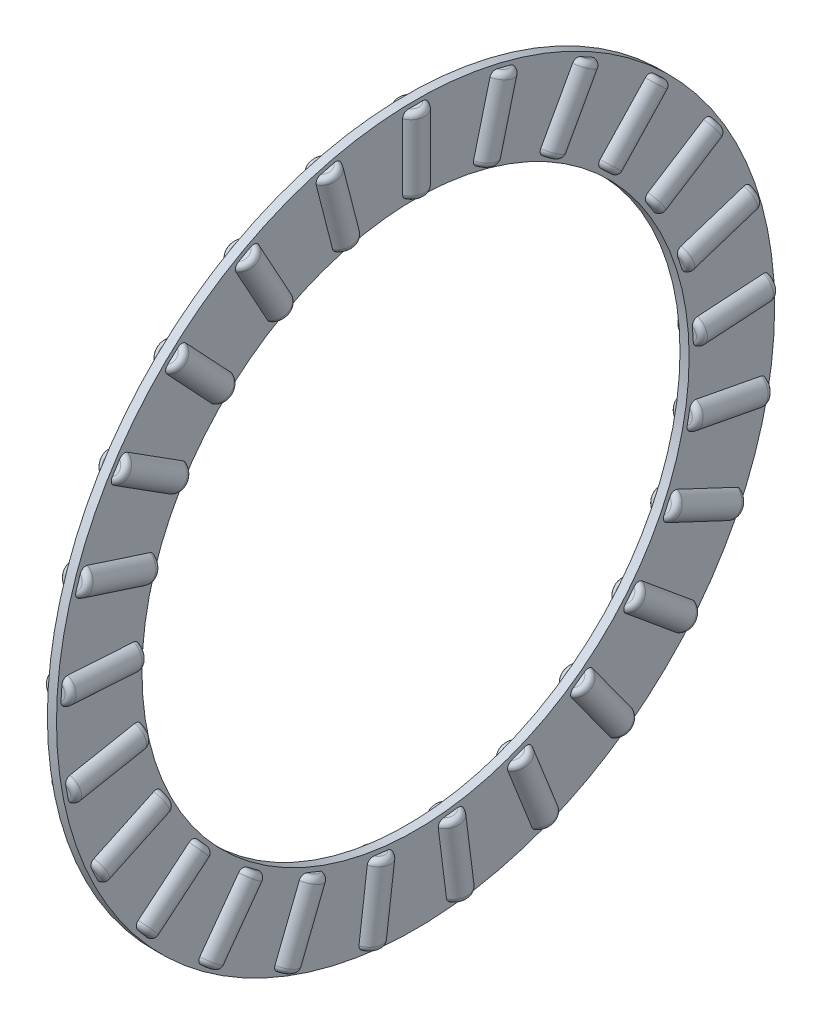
SolidWorks part; units mm, degrees
ref_plane "Plane1" through (0, 0, 0) normal (0, 0, 1) x (1, 0, 0)
ref_plane "Plane2" through (0, 0, 0) normal (0, 1, 0) x (1, 0, 0)
ref_plane "Plane3" through (0, 0, 0) normal (1, 0, 0) x (0, 0, -1)
sketch "Clipboard" plane through (0, 0, 0) normal (0, 0, 1) x (1, 0, 0)
  line L0 (-10, 0) -> (10, 0) construction
  line L1 (0, 0) -> (20.2657, -9.45)
  line L2 (0, 0) -> (41.9167, 19.5461)
  line L3 (0, 0) -> (20.2657, -9.45)
  line L4 (0, 0) -> (-22.3471, -0.7804)
  dimension "BallCLRad" = 46.25
  dimension "Count" = 25
  dimension "Show_count" = 25
  dimension "Max_count" = 25
  dimension "Min_count" = 2
sketch "CagSpiSke" plane through (0, 0, 0) normal (0, 0, 1) x (1, 0, 0)
  line L5 (-34.925, 0) -> (34.925, 0) construction
  line L6 (-0.6667, 52.5) -> (0.6667, 52.5)
  line L7 (-0.6667, 52.5) -> (-0.6667, 40)
  line L8 (-0.6667, 40) -> (0.6667, 40)
  line L9 (0.6667, 52.5) -> (0.6667, 40)
  dimension "ID" = 80
  dimension "OD" = 105
  dimension "Thickness" = 1.3333
  dimension "HalfThick" = 0.6667
revolve "CageSpine" add sketch "CagSpiSke" angle 360 about L5
ref_axis "Axis1" through (-50, 0, 0) along (1, 0, 0)
sketch "RolDetSke" plane through (0, 0, 0) normal (0, 0, 1) x (1, 0, 0)
  line L0 (0, 33.02) -> (0, 55.88) construction
  line L3 (0, 51.875) -> (1.2, 51.875)
  line L4 (0, 51.875) -> (0, 40.625)
  line L5 (0, 40.625) -> (1.2, 40.625)
  line L6 (2, 51.075) -> (2, 41.425)
  arc A0 (2, 41.425) -> (1.2, 40.625) centre (1.2, 41.425) cw
  arc A1 (1.2, 51.875) -> (2, 51.075) centre (1.2, 51.075) cw
  dimension "radius" = 0.8
  dimension "Roller_diameter" = 4
  dimension "Cyl_Len" = 11.25
  dimension "offset" = 40.625
revolve "RollerDetailed" add sketch "RolDetSke" angle 360 about L0
pattern_circular "RollersDetailed" count 25 every 14.4 about axis through (-50, 0, 0) along (1, 0, 0) of "RollerDetailed"
sketch "RolSimSke" plane through (0, 0, 0) normal (0, 0, 1) x (1, 0, 0)
  line L1 (-17.78, 0) -> (12.7, 0) construction
  line L3 (-1.2, 51.875) -> (1.2, 51.875)
  line L4 (-2, 51.075) -> (-2, 41.425)
  line L5 (-1.2, 40.625) -> (1.2, 40.625)
  line L6 (2, 51.075) -> (2, 41.425)
  arc A0 (-2, 41.425) -> (-1.2, 40.625) centre (-1.2, 41.425) ccw
  arc A1 (-1.2, 51.875) -> (-2, 51.075) centre (-1.2, 51.075) ccw
  arc A2 (2, 51.075) -> (1.2, 51.875) centre (1.2, 51.075) ccw
  arc A3 (1.2, 40.625) -> (2, 41.425) centre (1.2, 41.425) ccw
  dimension "Rol_rad" = 0.8
  dimension "Roller_diameter" = 4
  dimension "Cyl_Len" = 11.25
  dimension "offset" = 40.625
  dimension "Halfdia" = 2
revolve "RollersSimplified" [suppressed] add sketch "RolSimSke" angle 360 about L1
equation "\"BallCLRad@Clipboard\" =  ( \"OD@CagSpiSke\" + \"ID@CagSpiSke\" )  / 4"
equation "\"offset@RolSimSke\" = \"BallCLRad@Clipboard\" - \"Cyl_Len@RolSimSke\" / 2"
equation "\"offset@RolDetSke\" = \"BallCLRad@Clipboard\" - \"Cyl_Len@RolDetSke\" / 2"
equation "\"Thickness@CagSpiSke\" =  \"Roller_diameter@RolDetSke\"  / 3"
equation "\"HalfThick@CagSpiSke\" = \"Thickness@CagSpiSke\" / 2"
equation "\"radius@RolDetSke\" =  ( \"Roller_diameter@RolDetSke\" - \"Thickness@CagSpiSke\" )  * 0.6 / 2"
equation "\"Roller_diameter@RolSimSke\" = \"Roller_diameter@RolDetSke\""
equation "\"Cyl_Len@RolSimSke\" = \"Cyl_Len@RolDetSke\""
equation "\"Rol_rad@RolSimSke\" = \"radius@RolDetSke\""
equation "\"Halfdia@RolSimSke\" = \"Roller_diameter@RolSimSke\" / 2"
equation "\"Max_count@Clipboard\" = int( 3.14159265 / atn(( \"Roller_diameter@RolDetSke\" / 2) / sqr( \"offset@RolDetSke\"  *  \"offset@RolDetSke\" - ( \"Roller_diameter@RolDetSke\" / 2) *  ( \"Roller_diameter@RolDetSke\" "
equation "\"Max_count@Clipboard\" = ((sgn( \"Max_count@Clipboard\" - \"Count@Clipboard\" )-1)*( \"Max_count@Clipboard\" - \"Count@Clipboard\" ))/-2+ \"Count@Clipboard\""
equation "\"Count@RollersDetailed\" = int( \"Show_count@Clipboard\" ) "
equation "\"Count@RollersDetailed\" = ((sgn( \"Count@RollersDetailed\" - \"Max_count@Clipboard\" )-1)*( \"Count@RollersDetailed\" - \"Max_count@Clipboard\" ))/-2+ \"Max_count@Clipboard\""
equation "\"Count@RollersDetailed\" = ((sgn( \"Count@RollersDetailed\" - \"Min_count@Clipboard\" )+1)*( \"Count@RollersDetailed\" - \"Min_count@Clipboard\"))/2 +\"Min_count@Clipboard\""
equation "\"Angle@RollersDetailed\" = 360.0 / \"Max_count@Clipboard\""
